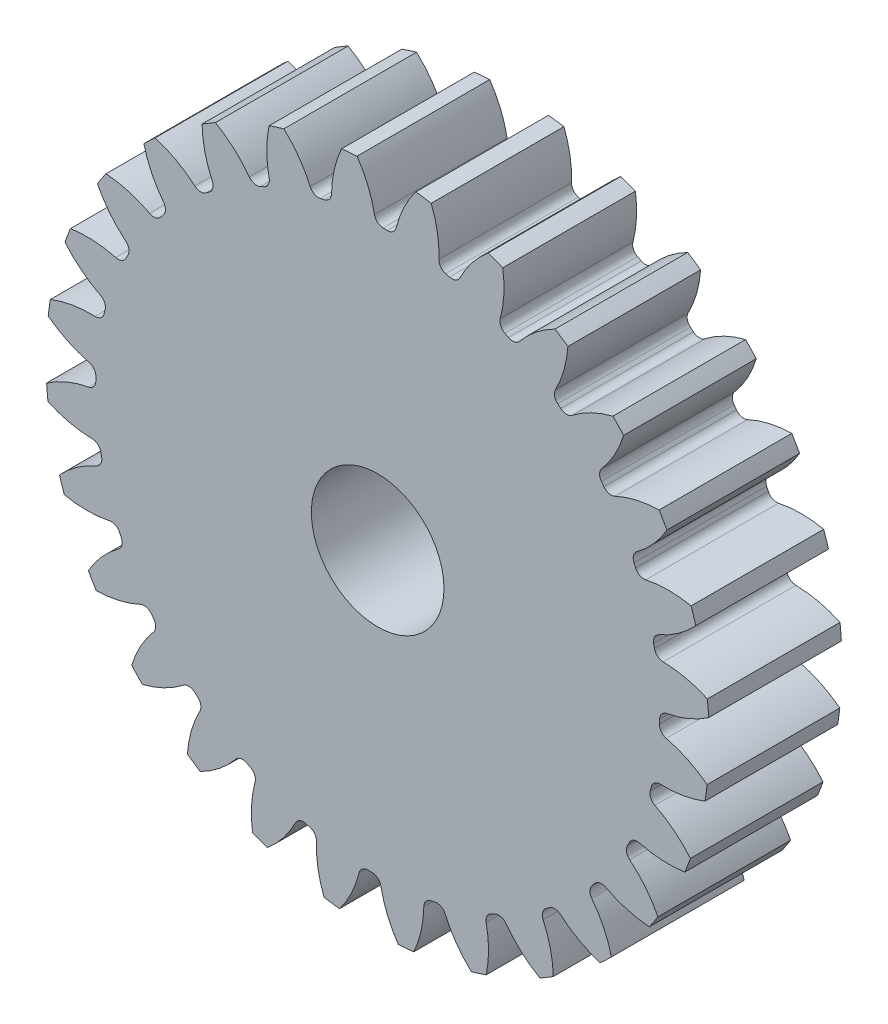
SolidWorks part; units mm, degrees
ref_plane "Front" through (0, 0, 0) normal (0, 0, 1) x (1, 0, 0)
ref_plane "Top" through (0, 0, 0) normal (0, 1, 0) x (1, 0, 0)
ref_plane "Right" through (0, 0, 0) normal (1, 0, 0) x (0, 0, -1)
sketch "Sketch3" plane through (0, 0, 0) normal (0, 0, 1) x (1, 0, 0)
  circle A0 centre (0, 0) radius 254
  dimension "od" = 508
extrude "gearBody" add sketch "Sketch3" along normal blind 101.6
sketch "Sketch2" plane through (0, 0, 0) normal (0, 0, 1) x (1, 0, 0)
  line L0 (0, 0) -> (205.8125, 85.2503) construction
  line L1 (252.7856, -29.5901) -> (0, 0) construction
  line L2 (0, 0) -> (36.3143, 0) construction
  line L3 (236.9645, 6.9597) -> (236.2608, -19.5299) construction
  line L5 (236.6127, -6.2851) -> (0, 0) construction
  line L7 (0, 0) -> (222.7698, 0) construction
  arc A0 (222.7533, 2.7101) -> (222.2953, -14.5319) centre (0, 0) ccw construction
  arc A1 (253.5088, 15.7886) -> (252.3131, -29.2247) centre (0, 0) ccw construction
  arc A2 (236.9645, 6.9597) -> (236.2608, -19.5299) centre (0, 0) ccw construction
  arc A3 (215.7771, -7.2842) -> (215.8595, -4.1814) centre (0, 0) ccw
  arc A4 (252.7856, -29.5901) -> (221.0267, -14.211) centre (200.9964, -96.0563) ccw
  arc A5 (252.7856, -29.5901) -> (254, 16.1284) centre (0, 0) ccw
  arc A6 (254, 16.1284) -> (221.4695, 2.457) centre (205.8125, 85.2503) cw
  arc A7 (215.8595, -4.1814) -> (221.4695, 2.457) centre (222.7501, -4.3148) cw
  arc A8 (221.0267, -14.211) -> (215.7771, -7.2842) centre (222.665, -7.5167) cw
  point P6 (254, 16.1284)
  point P22 (252.7856, -29.5901)
  dimension "baseDia" = 445.5396
  dimension "od" = 508
  dimension "pd" = 474.1333
  dimension "rd" = 431.8
  dimension "rFillet" = 6.8919
  dimension "pointX" = 254
  dimension "pointY" = 16.1284
  dimension "CTT" = 26.4896
  dimension "flankCenterAngle" = 22.5
extrude "toothCut" cut sketch "Sketch2" along normal through all
pattern_circular "CirPattern1" count 28 over 360 about axis through (0, 0, 0) along (0, 0, 1) of "toothCut"
sketch "hub1Dia" plane through (0, 0, 0) normal (0, 0, -1) x (-1, 0, 0)
  circle A0 centre (0, 0) radius 12.7
  dimension "hub1Dia" = 25.4
sketch "hub2Dia" plane through (0, 0, 101.6) normal (0, 0, 1) x (1, 0, 0)
  circle A0 centre (0, 0) radius 12.7
  dimension "hub2dia" = 25.4
sketch "boreDia" plane through (0, 0, 0) normal (0, 0, 1) x (1, 0, 0)
  circle A0 centre (0, 0) radius 50.8
  dimension "boreDia" = 101.6
extrude "bore" cut sketch "boreDia" against normal mid plane 25400
